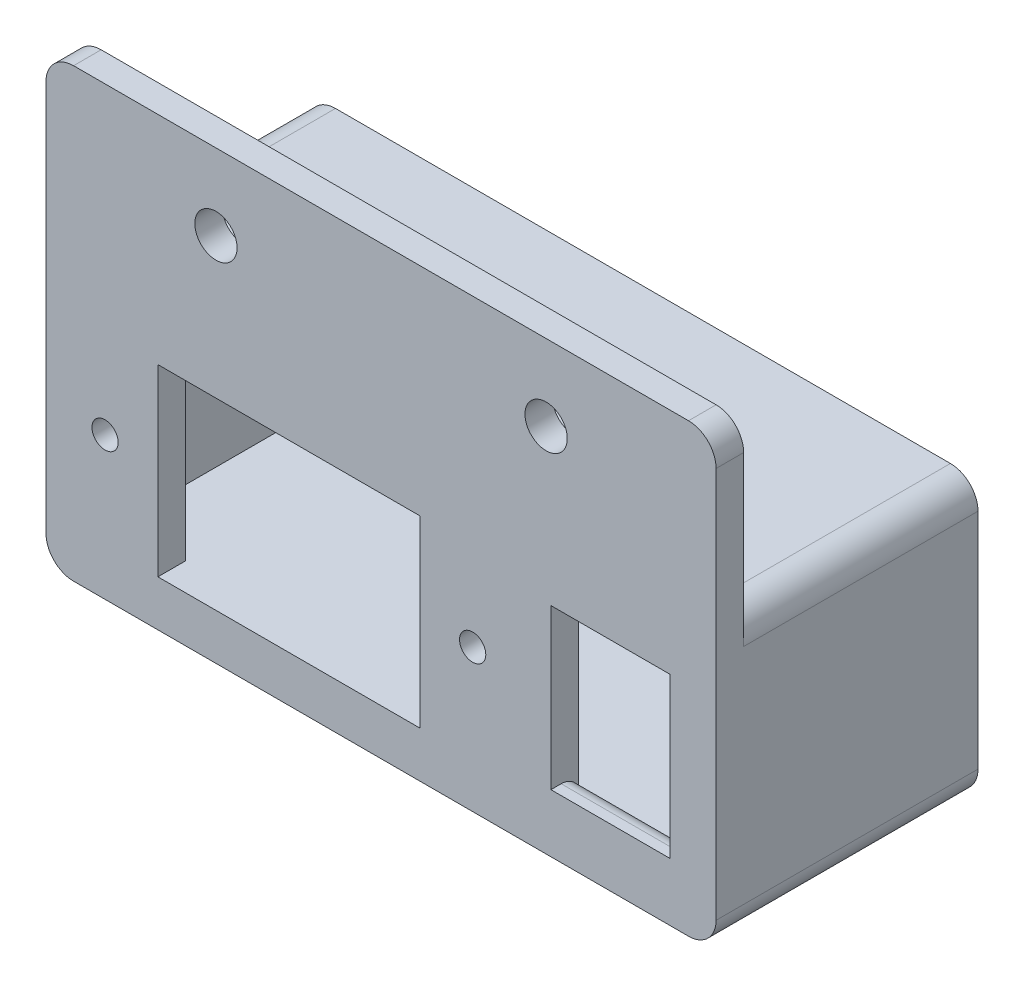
SolidWorks part; units mm, degrees
ref_plane "Front Plane" through (0, 0, 0) normal (0, 0, 1) x (1, 0, 0)
ref_plane "Top Plane" through (0, 0, 0) normal (0, 1, 0) x (1, 0, 0)
ref_plane "Right Plane" through (0, 0, 0) normal (1, 0, 0) x (0, 0, -1)
ref_plane "Plane1" through (0, 0, 0) normal (0, 0, -1) x (-1, 0, 0)
ref_plane "Plane2" through (0, 0, 3.8) normal (0, 0, -1) x (-1, 0, 0)
sketch "Sketch18" plane through (0, 0, 0) normal (0, 0, 1) x (1, 0, 0)
  line L1 (-23.75, 10) -> (4.75, 10)
  line L2 (-23.75, 10) -> (-23.75, -10)
  line L3 (-23.75, -10) -> (4.75, -10)
  line L4 (4.75, 10) -> (4.75, -10)
  line L5 (19.015, 8.6756) -> (31.985, 8.6756)
  line L6 (19.015, 8.6756) -> (19.015, -8.6756)
  line L7 (19.015, -8.6756) -> (31.985, -8.6756)
  line L8 (31.985, 8.6756) -> (31.985, -8.6756)
  line L11 (-35.9266, 0.5) -> (-35.9266, 33.5776)
  line L12 (0, 33.5776) -> (-35.9266, 33.5776)
  line L14 (-35.9266, 0.5) -> (-35.9266, -15)
  line L15 (-9.5, -15) -> (-35.9266, -15)
  line L16 (36.985, 0) -> (36.985, -15)
  line L17 (-9.5, -15) -> (36.985, -15)
  line L19 (-35.9266, 33.5776) -> (36.985, 33.5776)
  line L20 (-35.9266, 33.5776) -> (-35.9266, -15)
  line L21 (-35.9266, -15) -> (36.985, -15)
  line L22 (36.985, 33.5776) -> (36.985, -15)
  line L166 (31.985, -8.6756) -> (31.985, 8.6756)
  line L168 (19.015, 8.6756) -> (19.015, -8.6756)
  line L178 (4.75, 10) -> (-23.75, 10)
  line L190 (-23.75, -10) -> (4.75, -10)
  line L206 (4.75, -10) -> (4.75, 10)
  line L211 (-23.75, 10) -> (-23.75, -10)
  line L215 (31.985, -8.6756) -> (19.015, -8.6756)
  line L219 (19.015, 8.6756) -> (31.985, 8.6756)
  circle A0 centre (-17.9633, 25) radius 2.3
  circle A1 centre (10.5, 0.5) radius 1.4266
  circle A2 centre (-29.5, 0.5) radius 1.4266
  circle A4 centre (18.4925, 25) radius 2.3
extrude "Boss-Extrude1" add sketch "Sketch18" along normal blind 3 contours L22 L19 L12 L11 L14 L15 L17 L16 A4 A2 A1 A0 L1 L4 L3 L2 L5 L8 L7 L6
sketch "Sketch19" plane through (0, 0, 0) normal (0, 0, -1) x (-1, 0, 0)
  line L0 (-33.985, 10.3) -> (32.9266, 10.3)
  line L2 (32.9266, 10.3) -> (32.9266, -12)
  line L3 (9.5, -12) -> (32.9266, -12)
  line L4 (9.5, -12) -> (-33.985, -12)
  line L5 (9.5, -15) -> (-36.985, -15)
  line L6 (-36.985, 13.3) -> (-36.985, -15)
  line L7 (-33.985, 10.3) -> (-33.985, -12)
  line L9 (9.5, -15) -> (35.9266, -15)
  line L10 (35.9266, 13.3) -> (35.9266, -15)
  line L15 (-36.985, 13.3) -> (35.9266, 13.3)
  dimension "D1" = 3
extrude "Boss-Extrude3" add sketch "Sketch19" along normal blind 21
sketch "Sketch20" plane through (0, 0, 0) normal (0, 0, -1) x (-1, 0, 0)
  line L0 (-36.985, 13.3) -> (-36.985, 15.3)
  line L1 (-36.985, 33.5776) -> (-36.985, 13.3) construction
  line L2 (30.9266, 10.3) -> (30.9266, -10)
  line L3 (-36.985, 15.3) -> (35.9266, 15.3)
  line L4 (-36.985, 15.3) -> (-36.985, 13.3)
  line L5 (-36.985, 15.3) -> (35.9266, 15.3)
  line L6 (35.9266, 15.3) -> (35.9266, 13.3)
  line L7 (-36.985, 15.3) -> (35.9266, 15.3)
  line L8 (-36.985, 15.3) -> (-36.985, -15)
  line L9 (-36.985, -15) -> (35.9266, -15)
  line L10 (35.9266, 15.3) -> (35.9266, -15)
  line L11 (-36.985, 15.3) -> (-36.985, -15)
  line L12 (-36.985, -15) -> (35.9266, -15)
  line L13 (35.9266, 15.3) -> (35.9266, -15)
  line L14 (-31.985, 10.3) -> (30.9266, 10.3)
  line L15 (-31.985, 10.3) -> (-31.985, -10)
  line L16 (-31.985, -10) -> (30.9266, -10)
  line L17 (-31.985, 15.3) -> (-31.985, -15) construction
  line L18 (-36.985, 10.3) -> (35.9266, 10.3) construction
  line L19 (-36.985, -10) -> (35.9266, -10) construction
  line L20 (30.9266, 15.3) -> (30.9266, -15) construction
  dimension "D1" = 5
  dimension "D2" = 5
extrude "Boss-Extrude4" add sketch "Sketch20" along normal blind 21 contours L3 M6 M3 M4 | L10 L8 L9 L16 L15 L14 L2 M3
fillet "Fillet1" radius 3 6 edges at (36.985, 15.3, -10.5) (-35.9266, 15.3, -10.5) (-35.9266, -15, -9) (36.985, -15, -9) (36.985, 33.5776, 1.5) (-35.9266, 33.5776, 1.5)
sketch "Sketch23" plane through (0, 0, -21) normal (0, 0, -1) x (-1, 0, 0)
  line L0 (30.9266, 10.3) -> (-31.985, 10.3) construction
  line L1 (-31.985, 10.3) -> (-31.985, -10) construction
  line L2 (-31.985, -10) -> (30.9266, -10) construction
  line L3 (30.9266, 10.3) -> (30.9266, -10) construction
  line L4 (35.9266, -12) -> (35.9266, 12.3)
  line L5 (32.9266, 15.3) -> (-33.985, 15.3)
  line L6 (-36.985, 12.3) -> (-36.985, -12)
  line L7 (-33.985, -15) -> (32.9266, -15)
  line L8 (35.9266, -12) -> (35.9266, 12.3)
  line L9 (32.9266, 15.3) -> (-33.985, 15.3)
  line L10 (-36.985, 12.3) -> (-36.985, -12)
  line L11 (-33.985, -15) -> (32.9266, -15)
  line L12 (30.9266, 10.3) -> (-31.985, 10.3)
  line L13 (-31.985, 10.3) -> (-31.985, -10)
  line L14 (-31.985, -10) -> (30.9266, -10)
  line L15 (30.9266, 10.3) -> (30.9266, -10)
  arc A4 (35.9266, 12.3) -> (32.9266, 15.3) centre (32.9266, 12.3) ccw
  arc A5 (-33.985, 15.3) -> (-36.985, 12.3) centre (-33.985, 12.3) ccw
  arc A6 (-36.985, -12) -> (-33.985, -15) centre (-33.985, -12) ccw
  arc A7 (32.9266, -15) -> (35.9266, -12) centre (32.9266, -12) ccw
  arc A8 (35.9266, 12.3) -> (32.9266, 15.3) centre (32.9266, 12.3) ccw
  arc A9 (-33.985, 15.3) -> (-36.985, 12.3) centre (-33.985, 12.3) ccw
  arc A10 (-36.985, -12) -> (-33.985, -15) centre (-33.985, -12) ccw
  arc A11 (32.9266, -15) -> (35.9266, -12) centre (32.9266, -12) ccw
  dimension "D1" = 0
sketch "Sketch24" plane through (-35.9266, 0, 0) normal (-1, 0, 0) x (0, 0, 1)
  line L9 (-12.9375, 4.0023) -> (-12.9375, 4.15)
  circle A0 centre (-15.8063, 0.5352) radius 4.5
extrude "Cut-Extrude3" cut sketch "Sketch24" against normal blind 10 contours A0
extrude "Boss-Extrude7" add sketch "Sketch23" along normal blind 3
sketch "Sketch25" plane through (0, 0, -24) normal (0, 0, -1) x (-1, 0, 0)
  line L4 (35.9266, -12) -> (35.9266, 12.3)
  line L5 (32.9266, 15.3) -> (-33.985, 15.3)
  line L6 (-36.985, 12.3) -> (-36.985, -12)
  line L7 (-33.985, -15) -> (32.9266, -15)
  line L8 (35.9266, -12) -> (35.9266, 12.3)
  line L9 (32.9266, 15.3) -> (-33.985, 15.3)
  line L10 (-36.985, 12.3) -> (-36.985, -12)
  line L11 (-33.985, -15) -> (32.9266, -15)
  arc A4 (32.9266, -15) -> (35.9266, -12) centre (32.9266, -12) ccw
  arc A5 (35.9266, 12.3) -> (32.9266, 15.3) centre (32.9266, 12.3) ccw
  arc A6 (-33.985, 15.3) -> (-36.985, 12.3) centre (-33.985, 12.3) ccw
  arc A7 (-36.985, -12) -> (-33.985, -15) centre (-33.985, -12) ccw
  arc A8 (32.9266, -15) -> (35.9266, -12) centre (32.9266, -12) ccw
  arc A9 (35.9266, 12.3) -> (32.9266, 15.3) centre (32.9266, 12.3) ccw
  arc A10 (-33.985, 15.3) -> (-36.985, 12.3) centre (-33.985, 12.3) ccw
  arc A11 (-36.985, -12) -> (-33.985, -15) centre (-33.985, -12) ccw
  dimension "D1" = 0
extrude "Boss-Extrude8" add sketch "Sketch25" along normal blind 1.5
fillet "Fillet2" radius 2 2 edges at (31.985, 9.4878, 0) (25.5, 8.6756, 0)
fillet "Fillet3" radius 2 2 edges at (31.985, -9.3378, 0) (25.5, -8.6756, 0)
sketch "Sketch27" plane through (0, 0, 0) normal (0, 0, -1) x (-1, 0, 0)
  circle A1 centre (-18.4925, 25.3) radius 2.3
  circle A2 centre (17.4341, 25.3) radius 2.3
sketch "Sketch28" plane through (0, 0, 3) normal (0, 0, 1) x (1, 0, 0)
  circle A0 centre (-17.9633, 25) radius 2.3 construction
  circle A1 centre (18.4925, 25) radius 2.3 construction
  circle A2 centre (-17.9633, 25) radius 2.3
  circle A3 centre (18.4925, 25) radius 2.3
extrude "Boss-Extrude9" add sketch "Sketch28" against normal blind 3
extrude "Cut-Extrude4" cut sketch "Sketch27" against normal blind 3
